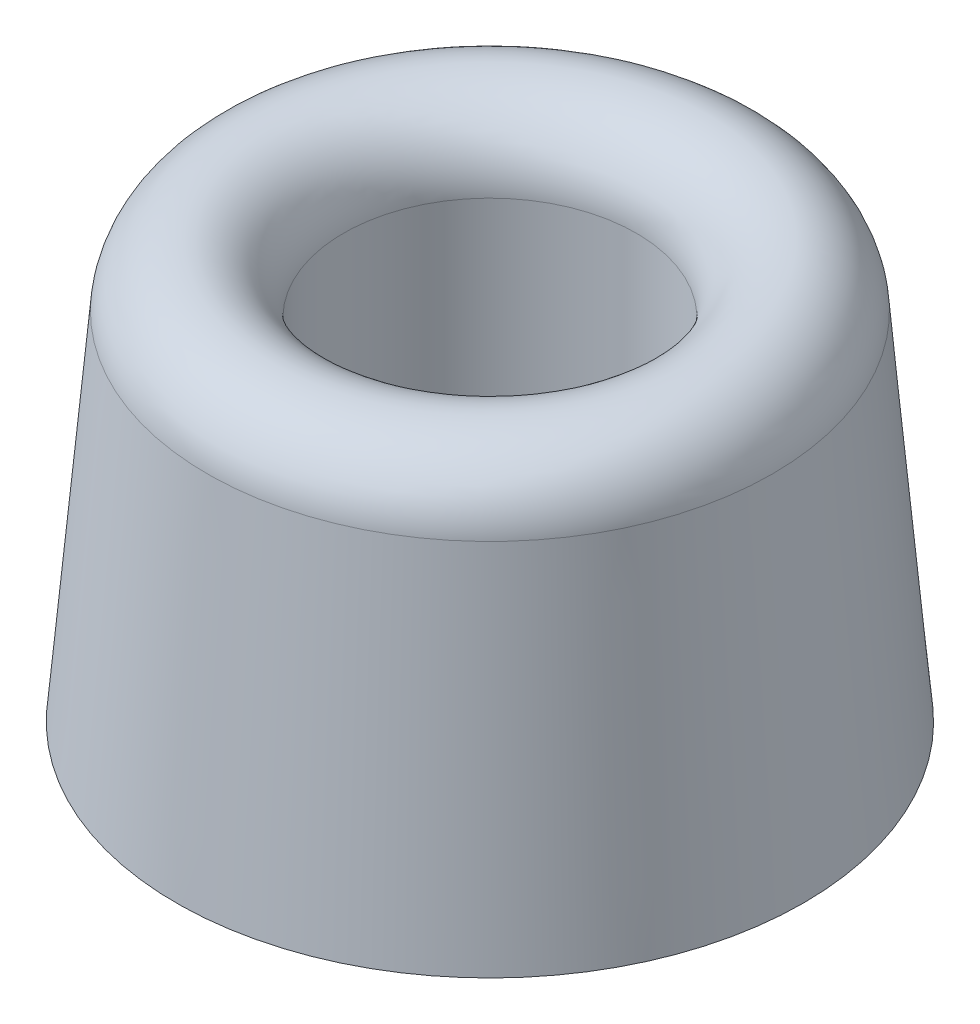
SolidWorks part; units mm, degrees
ref_plane "Front" through (0, 0, 0) normal (0, 0, 1) x (1, 0, 0)
ref_plane "Top" through (0, 0, 0) normal (0, 1, 0) x (1, 0, 0)
ref_plane "Right" through (0, 0, 0) normal (1, 0, 0) x (0, 0, -1)
sketch "Sketch1" plane through (0, 0, 0) normal (0, 0, 1) x (1, 0, 0)
  line L0 (11.9062, -4.7625) -> (-11.9062, -4.7625) construction
  line L1 (0, -4.7625) -> (0, 11.1125) construction
  line L2 (5.5562, 0) -> (-5.5562, 0) construction
  line L3 (2.7781, -4.7625) -> (-2.7781, -4.7625) construction
  point P7 (0, 0)
  point P11 (-2.7781, -4.7625)
  point P12 (2.7781, -4.7625)
  point P13 (5.5562, 0)
  point P14 (-5.5562, 0)
  dimension "OD" = 23.8125
  dimension "Height" = 15.875
  dimension "Counterbore Diameter" = 11.1125
  dimension "Mounting Surface Height" = 4.7625
  dimension "Mounting Hole Diameter" = 5.5562
sketch "Sketch2" plane through (0, 0, 0) normal (0, 0, 1) x (1, 0, 0)
  line L0 (-11.9062, -4.7625) -> (-10.5174, 11.1125) construction
  line L1 (-10.5174, 11.1125) -> (-5.5563, 11.1125) construction
  line L2 (-5.5563, 11.1125) -> (-5.5562, 0) construction
  line L3 (-5.5562, 0) -> (-2.7781, 0)
  line L4 (5.5562, 0) -> (-5.5562, 0) construction
  line L5 (-2.7781, 0) -> (-2.7781, -4.7625)
  line L6 (-2.7781, -4.7625) -> (-11.9062, -4.7625)
  line L7 (-10.5174, 11.1125) -> (10.5174, 11.1125) construction
  line L8 (-10.7241, 8.7493) -> (-11.9062, -4.7625)
  line L9 (-5.5563, 8.5236) -> (-5.5562, 0)
  arc A0 (-10.7241, 8.7493) -> (-5.5563, 8.5236) centre (-8.1451, 8.5236) cw
  dimension "D1" = 5
revolve "Revolve1" add sketch "Sketch2" angle 360 about L1
sketch "Sketch4" plane through (0, 0, 0) normal (0, 0, 1) x (1, 0, 0)
  line L0 (-8.1451, 11.1125) -> (-8.1451, -4.7625) construction
  line L1 (-2.7781, -4.7625) -> (-11.9062, -4.7625) construction
  line L2 (0, 0) -> (0, 4.6584) construction
  line L3 (2.7781, 0) -> (-2.7781, 0) construction
  line L10 (-2.7781, 0) -> (-2.7781, -4.7625) construction
  line L11 (-5.5562, 0) -> (-2.7781, 0) construction
  line L12 (-5.5562, 8.5236) -> (-5.5562, 0) construction
  line L13 (-2.7781, 0) -> (-2.7781, -4.7625)
  line L14 (-5.5562, 0) -> (-2.7781, 0)
  line L15 (-5.5562, 8.5236) -> (-5.5562, 0)
  line L16 (-10.5174, 11.1125) -> (-5.5563, 11.1125) construction
  line L17 (2.7781, 0) -> (2.7781, -4.7625)
  line L18 (5.5562, 0) -> (2.7781, 0)
  line L19 (5.5562, 8.5236) -> (5.5562, 0)
  arc A0 (5.5562, 8.5236) -> (8.1451, 11.1125) centre (8.1451, 8.5236) cw
  arc A4 (-5.5562, 8.5236) -> (-10.7241, 8.7493) centre (-8.1451, 8.5236) ccw construction
  arc A5 (-5.5562, 8.5236) -> (-8.1451, 11.1125) centre (-8.1451, 8.5236) ccw
  point P5 (-8.1451, 11.1125)
